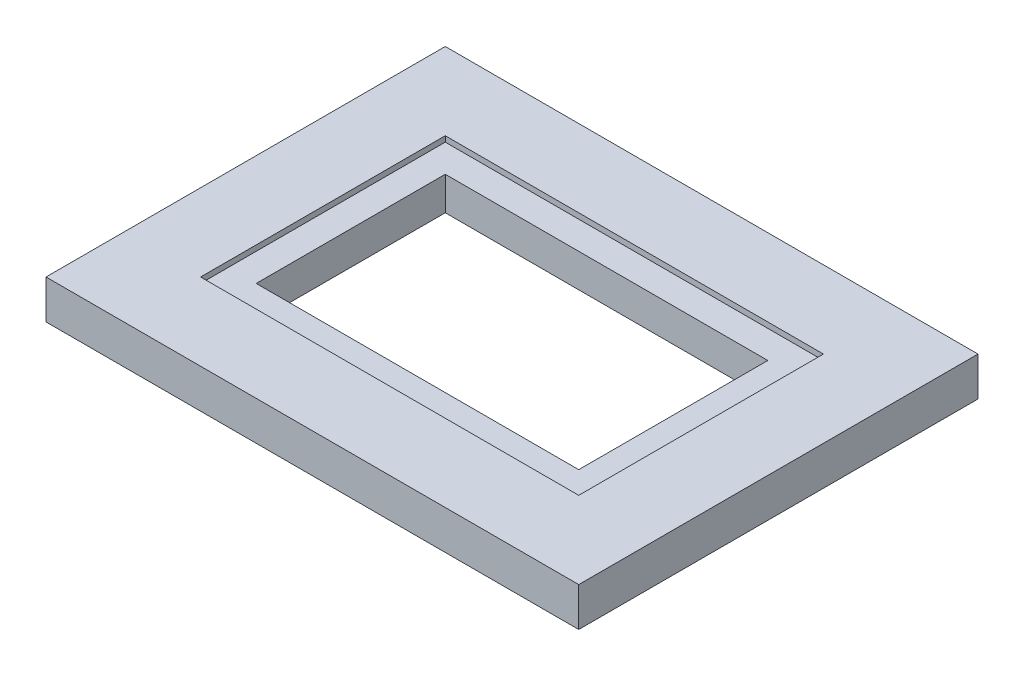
SolidWorks part; units mm, degrees
ref_plane "Front Plane" through (0, 0, 0) normal (0, 0, 1) x (1, 0, 0)
ref_plane "Top Plane" through (0, 0, 0) normal (0, 1, 0) x (1, 0, 0)
ref_plane "Right Plane" through (0, 0, 0) normal (1, 0, 0) x (0, 0, -1)
sketch "Sketch1" plane through (0, 0, 0) normal (0, 1, 0) x (1, 0, 0)
  line L1 (92.075, -53.975) -> (-92.075, -53.975)
  line L2 (92.075, -53.975) -> (92.075, 53.975)
  line L3 (92.075, 53.975) -> (-92.075, 53.975)
  line L4 (-92.075, -53.975) -> (-92.075, 53.975)
  line L5 (92.075, -53.975) -> (-92.075, 53.975) construction
  line L6 (92.075, 53.975) -> (-92.075, -53.975) construction
  line L7 (152.075, -113.975) -> (-152.075, -113.975)
  line L8 (152.075, -113.975) -> (152.075, 113.975)
  line L9 (152.075, 113.975) -> (-152.075, 113.975)
  line L10 (-152.075, -113.975) -> (-152.075, 113.975)
  line L11 (152.075, -113.975) -> (-152.075, 113.975) construction
  line L12 (152.075, 113.975) -> (-152.075, -113.975) construction
  point P0 (0, 0)
  point P6 (0, 0)
  dimension "D1" = 107.95
  dimension "D2" = 184.15
  dimension "D3" = 60
  dimension "D4" = 60
extrude "Boss-Extrude1" add sketch "Sketch1" along normal blind 19.05
ref_plane "Plane1" through (0, 22.23, 0) normal (0, 1, 0) x (1, 0, 0)
sketch "Sketch2" plane through (0, 22.23, 0) normal (0, 1, 0) x (1, 0, 0)
  line L18 (-107.95, 69.85) -> (-107.95, -69.85)
  line L22 (107.95, 69.85) -> (-107.95, 69.85)
  line L26 (107.95, -69.85) -> (107.95, 69.85)
  line L30 (-107.95, -69.85) -> (107.95, -69.85)
  line L32 (-152.075, 113.975) -> (-152.075, -113.975) construction
  line L33 (-152.075, -113.975) -> (152.075, -113.975) construction
  line L34 (152.075, -113.975) -> (152.075, 113.975) construction
  line L35 (152.075, 113.975) -> (-152.075, 113.975) construction
  line L40 (-152.075, 113.975) -> (-152.075, -113.975)
  line L41 (-152.075, -113.975) -> (152.075, -113.975)
  line L42 (152.075, -113.975) -> (152.075, 113.975)
  line L43 (152.075, 113.975) -> (-152.075, 113.975)
  line L44 (-152.075, 113.975) -> (-152.075, -113.975)
  line L45 (-152.075, -113.975) -> (152.075, -113.975)
  line L46 (152.075, -113.975) -> (152.075, 113.975)
  line L47 (152.075, 113.975) -> (-152.075, 113.975)
  dimension "D1" = 44.125
  dimension "D2" = 44.125
  dimension "D3" = 44.125
  dimension "D4" = 44.125
  dimension "D5" = 0
extrude "Boss-Extrude2" add sketch "Sketch2" against normal up to surface (3.18 mm away) contours L44 L45 L46 L47
